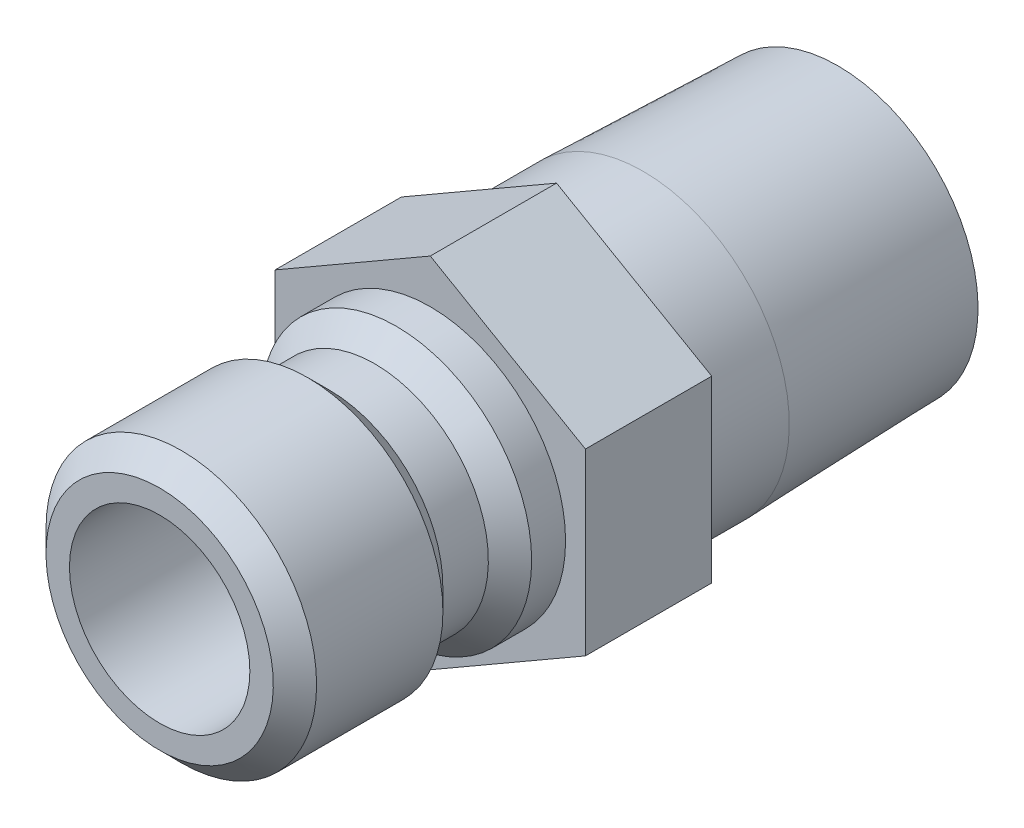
SolidWorks part; units mm, degrees
ref_plane "Front Plane" through (0, 0, 0) normal (0, 0, 1) x (1, 0, 0)
ref_plane "Top Plane" through (0, 0, 0) normal (0, 1, 0) x (1, 0, 0)
ref_plane "Right Plane" through (0, 0, 0) normal (1, 0, 0) x (0, 0, -1)
sketch "Sketch1" plane through (0, 0, 0) normal (1, 0, 0) x (0, 0, -1)
  line L0 (0, 0) -> (-12.7, 0) construction
  line L1 (-9.525, 3.175) -> (-9.525, 4.0005)
  line L2 (-3.556, 4.0005) -> (-3.556, 0) construction
  line L3 (-8.763, 4.7625) -> (-4.318, 4.7625)
  line L4 (0, 5.1435) -> (0, 0) construction
  line L5 (-3.556, 4.0005) -> (-1.9558, 4.0005)
  line L6 (-1.1938, 4.7625) -> (0, 4.7625)
  line L7 (0, 4.7625) -> (0, 5.1435)
  line L8 (-3.556, 4.0005) -> (-4.318, 4.7625)
  line L9 (-1.9558, 4.0005) -> (-1.1938, 4.7625)
  line L10 (-9.525, 4.0005) -> (-8.763, 4.7625)
  line L11 (-9.525, 3.175) -> (0.127, 3.175)
  line L12 (0, 5.1435) -> (7.493, 5.1435)
  line L13 (7.493, 5.1435) -> (14.351, 4.9292)
  line L14 (14.351, 4.9292) -> (14.351, 2.9464)
  line L15 (0, 0) -> (4.445, 0) construction
  line L16 (0.127, 3.175) -> (0.127, 2.9464)
  line L17 (0.127, 2.9464) -> (14.351, 2.9464)
  dimension "D1" = 9.525
  dimension "D2" = 1.6002
  dimension "D3" = 0.762
  dimension "D4" = 45
  dimension "D5" = 5.969
  dimension "D6" = 45
  dimension "D7" = 1.79
  dimension "D8" = 6.858
  dimension "D9" = 23.876
  dimension "D10" = 3.175
  dimension "D11" = 4.445
  dimension "D12" = 6.35
  dimension "D13" = 9.652
  dimension "D14" = 9.525
  dimension "D15" = 10.287
  dimension "D16" = 5.8928
revolve "Revolve1" add sketch "Sketch1" angle 360 about L0
sketch "Sketch2" plane through (0, 0, 0) normal (0, 0, 1) x (1, 0, 0)
  line L1 (-5.461, 3.1529) -> (-5.461, -3.1529)
  line L2 (-5.461, -3.1529) -> (0, -6.3058)
  line L3 (0, -6.3058) -> (5.461, -3.1529)
  line L4 (5.461, -3.1529) -> (5.461, 3.1529)
  line L5 (5.461, 3.1529) -> (0, 6.3058)
  line L6 (0, 6.3058) -> (-5.461, 3.1529)
  circle A0 centre (0, 0) radius 5.461 construction
  circle A1 centre (0, 0) radius 3.175 construction
  circle A2 centre (0, 0) radius 3.175
  dimension "D1" = 10.922
extrude "Boss-Extrude1" add sketch "Sketch2" against normal up to vertex (4.445 mm away)
